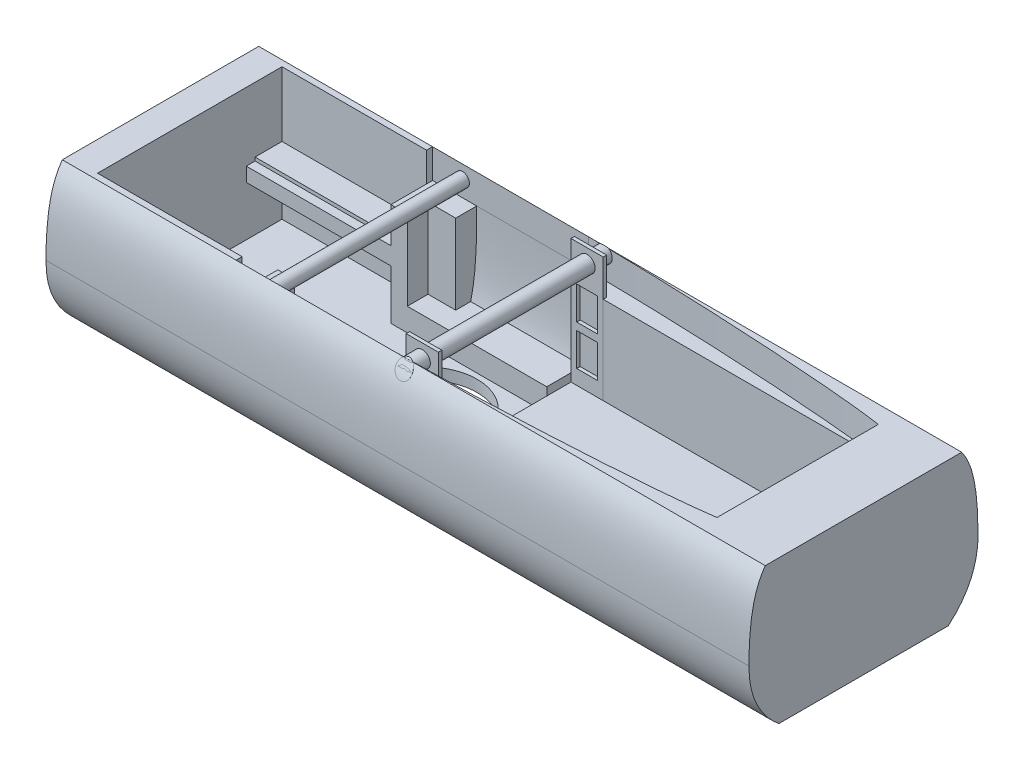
SolidWorks part; units mm, degrees
ref_plane "Front Plane" through (0, 0, 0) normal (0, 0, 1) x (1, 0, 0)
ref_plane "Top Plane" through (0, 0, 0) normal (0, 1, 0) x (1, 0, 0)
ref_plane "Right Plane" through (0, 0, 0) normal (1, 0, 0) x (0, 0, -1)
sketch "Sketch1" plane through (0, 0, 0) normal (0, 1, 0) x (1, 0, 0)
  line L0 (0, 0) -> (-260.7, 0) construction
  line L5 (0, 0) -> (0, -49)
  line L6 (0, -80) -> (-97, -80)
  line L7 (0, 0) -> (0, 49)
  line L8 (0, 49) -> (-135.2875, 49)
  line L9 (0, 49) -> (0, 68)
  line L10 (0, 68) -> (0, 80)
  line L11 (0, 80) -> (-97, 80)
  line L12 (-97, 80) -> (-97, 67)
  line L13 (-97, 67) -> (-121, 67)
  line L14 (-121, 67) -> (-121, 49)
  line L15 (-135.2875, 80) -> (-135.2875, 49)
  line L16 (0, -68) -> (0, -80)
  line L17 (0, -49) -> (0, -68)
  line L18 (0, -49) -> (-135.2875, -49)
  line L19 (-135.2875, -80) -> (-135.2875, -49)
  line L20 (-121, -67) -> (-121, -49)
  line L21 (-97, -67) -> (-121, -67)
  line L22 (-97, -80) -> (-97, -67)
  line L23 (-135.2875, 49) -> (-260.7, 49)
  line L24 (-260.7, 49) -> (-260.7, -49)
  line L25 (-260.7, -49) -> (-135.2875, -49)
  line L26 (-135.2875, 80) -> (-260.7, 80) construction
  line L27 (-260.7, 80) -> (-260.7, 49) construction
  line L28 (-97, 80) -> (-135.2875, 80) construction
  line L29 (0, 49) -> (266.7, 49)
  line L30 (266.7, 49) -> (266.7, -49)
  line L31 (266.7, -49) -> (0, -49)
  line L32 (0, 0) -> (266.7, 0) construction
  dimension "D1" = 97
  dimension "D2" = 12
  dimension "D3" = 19
  dimension "D4" = 13
  dimension "D5" = 24
  dimension "D6" = 18
  dimension "D7" = 98
  dimension "D8" = 139.7
  dimension "D9" = 14.2875
  dimension "D10" = 266.7
sketch "Sketch2" plane through (0, 0, 0) normal (0, 1, 0) x (1, 0, 0)
  line L0 (0, 49) -> (266.7, 49) construction
  line L1 (0, 49) -> (266.7, 49) construction
  line L2 (266.7, 49) -> (266.7, -49) construction
  line L3 (266.7, -49) -> (0, -49) construction
  line L4 (0, 0) -> (0, -49) construction
  line L5 (0, 0) -> (0, 49) construction
  line L6 (266.7, 49) -> (266.7, -49)
  line L7 (266.7, -49) -> (0, -49) construction
  line L8 (0, 0) -> (0, -49)
  line L9 (0, 0) -> (0, 49)
  line L10 (209.55, 49) -> (209.55, -49) construction
  line L11 (0, 0) -> (266.7, 0) construction
  line L12 (0, 49) -> (0, 70)
  line L13 (0, 70) -> (266.7, 70)
  line L14 (266.7, 70) -> (266.7, 49)
  line L15 (266.7, -70) -> (266.7, -49)
  line L16 (0, -70) -> (266.7, -70)
  line L17 (0, -49) -> (0, -70)
  spline S0 degree 3 poles (209.55, 49) (241.4641, 49.1492) (266.6642, 36.8994) (266.7, 17.25) knots 0 0 0 0 0.542084 0.542084 0.542084 0.542084 construction
  spline S1 degree 3 poles (209.55, -49) (241.4641, -49.1492) (266.6642, -36.8994) (266.7, -17.25) knots 0 0 0 0 0.542084 0.542084 0.542084 0.542084 construction
  dimension "D1" = 57.15
  dimension "D2" = 31.75
  dimension "D3" = 140
extrude "Boss-Extrude1" add sketch "Sketch2" along normal blind 13
sketch "Sketch3" plane through (0, 0, 0) normal (0, 1, 0) x (1, 0, 0)
  line L0 (0, 49) -> (-135.2875, 49) construction
  line L1 (0, -49) -> (-135.2875, -49) construction
  line L2 (0, -49) -> (0, -68) construction
  line L3 (0, -68) -> (0, -80) construction
  line L4 (-97, -80) -> (-97, -67) construction
  line L5 (-121, -67) -> (-121, -49) construction
  line L6 (-97, -67) -> (-121, -67) construction
  line L7 (0, -80) -> (-97, -80) construction
  line L8 (0, 49) -> (0, 68) construction
  line L9 (0, 68) -> (0, 80) construction
  line L10 (0, 80) -> (-97, 80) construction
  line L11 (-97, 80) -> (-97, 67) construction
  line L12 (-97, 67) -> (-121, 67) construction
  line L13 (-121, 67) -> (-121, 49) construction
  line L14 (0, 49) -> (-121, 49)
  line L15 (0, -49) -> (-121, -49)
  line L16 (0, -49) -> (0, -68)
  line L17 (0, -68) -> (0, -80)
  line L18 (-97, -80) -> (-97, -67)
  line L19 (-121, -67) -> (-121, -49)
  line L20 (-97, -67) -> (-121, -67)
  line L21 (0, -80) -> (-97, -80)
  line L22 (0, 49) -> (0, 68)
  line L23 (0, 68) -> (0, 80)
  line L24 (0, 80) -> (-97, 80)
  line L25 (-97, 80) -> (-97, 67)
  line L26 (-97, 67) -> (-121, 67)
  line L27 (-121, 67) -> (-121, 49)
extrude "Boss-Extrude2" add sketch "Sketch3" along normal blind 20 separate body
sketch "Sketch4" plane through (0, 0, 0) normal (0, 1, 0) x (1, 0, 0)
  line L0 (-97, 80) -> (-135.2875, 80) construction
  line L1 (-97, 80) -> (-97, 67) construction
  line L2 (-97, 67) -> (-121, 67) construction
  line L3 (-121, 67) -> (-121, 49) construction
  line L4 (0, 49) -> (-135.2875, 49) construction
  line L5 (-135.2875, 80) -> (-135.2875, 49) construction
  line L6 (-97, 80) -> (-135.2875, 80) construction
  line L7 (-97, 80) -> (-97, 67)
  line L8 (-97, 67) -> (-121, 67)
  line L9 (-121, 67) -> (-121, 49)
  line L10 (-121, 49) -> (-135.2875, 49)
  line L11 (-135.2875, 80) -> (-135.2875, 49)
  line L12 (-260.7, 0) -> (0, 0) construction
  line L13 (-260.7, 49) -> (-260.7, -49) construction
  line L14 (-135.2875, -80) -> (-135.2875, -49)
  line L15 (-121, -49) -> (-135.2875, -49)
  line L16 (-121, -67) -> (-121, -49)
  line L19 (-97, -80) -> (-135.2875, -80) construction
  line L20 (-135.2875, 80) -> (-135.2875, 105)
  line L21 (-135.2875, 105) -> (323.8, 105)
  line L22 (-135.2875, -105) -> (323.8, -105)
  line L23 (-135.2875, -80) -> (-135.2875, -105)
  line L24 (19, 49) -> (19, -49) construction
  line L25 (19, 49) -> (0, 49) construction
  line L26 (19, -49) -> (0, -49) construction
  line L27 (323.8, -105) -> (323.8, 105)
  line L35 (-121, -67) -> (-97, -67) construction
  line L36 (-97, -67) -> (-97, -80) construction
  line L37 (-97, -80) -> (0, -80) construction
  line L38 (0, -80) -> (0, -49) construction
  line L40 (266.7, 49) -> (266.7, -49) construction
  line L42 (0, 49) -> (0, 80) construction
  line L43 (0, 80) -> (-97, 80) construction
  line L44 (-121, -67) -> (-97, -67)
  line L45 (-97, -67) -> (-97, -80)
  line L46 (-97, -80) -> (0, -80)
  line L47 (0, -80) -> (0, -70)
  line L49 (266.7, 70) -> (266.7, -70)
  line L51 (0, 70) -> (0, 80)
  line L52 (0, 80) -> (-97, 80)
  line L53 (266.7, 70) -> (0, 70) construction
  line L54 (266.7, 70) -> (0, 70)
  line L55 (0, -70) -> (266.7, -70) construction
  line L56 (0, -70) -> (266.7, -70)
  line L57 (0, 49) -> (0, 70) construction
  line L58 (0, -70) -> (0, -49) construction
  dimension "D1" = 210
  dimension "D2" = 19
  dimension "D3" = 304.8
extrude "Boss-Extrude3" add sketch "Sketch4" along normal blind 89.2
sketch "Sketch5" plane through (0, 0, 0) normal (0, 1, 0) x (1, 0, 0)
  line L1 (-260.7, 49) -> (-260.7, -49) construction
  line L4 (-260.7, 49) -> (-260.7, -49)
  line L6 (-260.7, 80) -> (-260.7, 49) construction
  line L7 (-135.2875, 80) -> (-260.7, 80) construction
  line L8 (0, -49) -> (-135.2875, -49)
  line L9 (0, 49) -> (0, -49)
  line L10 (-135.2875, 49) -> (0, 49)
  line L11 (-135.2875, 105) -> (-135.2875, 49)
  line L12 (323.8, 105) -> (-135.2875, 105)
  line L13 (323.8, -105) -> (323.8, 105)
  line L14 (-135.2875, -105) -> (323.8, -105)
  line L15 (-135.2875, -49) -> (-135.2875, -105)
  line L19 (-135.2875, 105) -> (-135.2875, 80)
  line L20 (323.8, 105) -> (-135.2875, 105)
  line L21 (323.8, -105) -> (323.8, 105)
  line L22 (-135.2875, -105) -> (323.8, -105)
  line L23 (-135.2875, -80) -> (-135.2875, -105)
  line L24 (-260.7, 80) -> (-260.7, 49)
  line L25 (-135.2875, 80) -> (-260.7, 80)
  line L26 (-260.7, 0) -> (0, 0) construction
  line L27 (-135.2875, -80) -> (-260.7, -80)
  line L28 (-260.7, -80) -> (-260.7, -49)
  dimension "D1" = 0
extrude "Boss-Extrude4" add sketch "Sketch5" against normal blind 10
sketch "Sketch7" plane through (0, 89.2, 0) normal (0, 1, 0) x (1, 0, 0)
  line L0 (0, 0) -> (266.7, 0) construction
  line L1 (0, 70) -> (28, 70)
  line L2 (0, 70) -> (0, 73)
  line L3 (0, 73) -> (28, 73)
  line L4 (28, 70) -> (28, 73)
  line L5 (266.7, -70) -> (266.7, 70) construction
  line L6 (28, -70) -> (28, -73)
  line L7 (0, -73) -> (28, -73)
  line L8 (0, -70) -> (0, -73)
  line L9 (0, -70) -> (28, -70)
  dimension "D1" = 3
  dimension "D2" = 28
extrude "Cut-Extrude1" cut sketch "Sketch7" against normal up to surface (76.2 mm away) contours L3 L4 L1 L2
sketch "Sketch8" plane through (0, 13, 0) normal (0, 1, 0) x (1, 0, 0)
  line L0 (0, 0) -> (266.7, 0) construction
  line L1 (28, 73) -> (0, 73)
  line L2 (28, 73) -> (28, 70)
  line L3 (28, 70) -> (0, 70)
  line L4 (0, 73) -> (0, 70)
  line L5 (0, 49) -> (0, -49) construction
  line L6 (266.7, -70) -> (266.7, 70) construction
  line L7 (0, -73) -> (0, -70)
  line L8 (28, -70) -> (0, -70)
  line L9 (28, -73) -> (28, -70)
  line L10 (28, -73) -> (0, -73)
  line L11 (0, 73) -> (0, 49) construction
extrude "Boss-Extrude6" add sketch "Sketch8" along normal blind 107.95 separate body
sketch "Sketch9" plane through (0, 0, -70) normal (0, 0, 1) x (1, 0, 0)
  line L0 (14, 115.95) -> (14, 120.95) construction
  line L1 (0, 120.95) -> (28, 120.95) construction
  circle A0 centre (14, 108.95) radius 7
  dimension "D2" = 14
  dimension "D1" = 5
extrude "Boss-Extrude7" add sketch "Sketch9" along normal up to surface and the other way up to surface separate body
sketch "Sketch11" plane through (0, 0, 0) normal (0, 1, 0) x (1, 0, 0)
  line L0 (-88.9, 6.98) -> (-88.9, -6.98)
  line L1 (-22.86, 6.98) -> (-22.86, -6.98)
  line L2 (-55.88, 40) -> (-55.88, -40) construction
  line L3 (-88.9, 0) -> (0, 0) construction
  arc A0 (-22.86, 6.98) -> (-88.9, 6.98) centre (-55.88, 6.98) ccw
  arc A1 (-88.9, -6.98) -> (-22.86, -6.98) centre (-55.88, -6.98) ccw
  arc A2 (-22.86, -6.98) -> (-88.9, -6.98) centre (-55.88, -6.98) ccw construction
  arc A3 (-88.9, 6.98) -> (-22.86, 6.98) centre (-55.88, 6.98) ccw construction
  point P1 (-55.88, -40)
  point P3 (-55.88, 40)
  point P14 (-22.86, 0)
  dimension "D1" = 66.04
  dimension "D2" = 80
  dimension "D3" = 22.86
extrude "Cut-Extrude2" cut sketch "Sketch11" against normal blind 2
sketch "Sketch12" plane through (0, 0, -70) normal (0, 0, 1) x (1, 0, 0)
  line L0 (5, 60.625) -> (5, 54.275) construction
  line L1 (5, 89.2) -> (23, 89.2)
  line L2 (5, 89.2) -> (5, 60.625)
  line L3 (5, 60.625) -> (23, 60.625)
  line L4 (23, 89.2) -> (23, 60.625)
  line L5 (5, 89.2) -> (23, 60.625) construction
  line L6 (5, 60.625) -> (23, 89.2) construction
  line L7 (5, 54.275) -> (23, 54.275)
  line L8 (5, 54.275) -> (5, 25.7)
  line L9 (5, 25.7) -> (23, 25.7)
  line L10 (23, 54.275) -> (23, 25.7)
  line L11 (5, 54.275) -> (23, 25.7) construction
  line L12 (5, 25.7) -> (23, 54.275) construction
  line L14 (23, 60.625) -> (23, 54.275) construction
  line L15 (28, 89.2) -> (266.7, 89.2) construction
  line L16 (28, 120.95) -> (28, 13) construction
  line L17 (0, 120.95) -> (0, 13) construction
  line L18 (0, 13) -> (28, 13) construction
  point P0 (14, 74.9125)
  point P7 (14, 39.9875)
  dimension "D1" = 5
  dimension "D2" = 5
  dimension "D4" = 6.35
  dimension "D5" = 12.7
extrude "Cut-Extrude3" cut sketch "Sketch12" against normal up to surface and the other way up to surface
sketch "Sketch13" plane through (0, -10, 0) normal (0, 1, 0) x (1, 0, 0)
  line L0 (-135.2875, 105) -> (-286.1, 105)
  line L1 (-286.1, 105) -> (-286.1, -105)
  line L2 (-286.1, -105) -> (-135.2875, -105)
  line L3 (-260.7, 0) -> (-286.1, 0) construction
  line L4 (-260.7, 80) -> (-260.7, -80) construction
  line L6 (-135.2875, 80) -> (-260.7, 80) construction
  line L7 (-260.7, 80) -> (-260.7, -80) construction
  line L8 (-260.7, -80) -> (-135.2875, -80) construction
  line L9 (-135.2875, 105) -> (-135.2875, 80) construction
  line L10 (-135.2875, 105) -> (-135.2875, 80)
  line L11 (-260.7, -80) -> (-135.2875, -80)
  line L12 (-260.7, 80) -> (-260.7, -80)
  line L13 (-135.2875, 80) -> (-260.7, 80)
  line L14 (-135.2875, -80) -> (-135.2875, -105)
  dimension "D1" = 25.4
extrude "Boss-Extrude10" add sketch "Sketch13" along normal blind 124.6
sketch "Sketch15" plane through (-135.2875, 0, 0) normal (-1, 0, 0) x (0, 0, 1)
  line L0 (-80, 89.2) -> (-80, 0) construction
  line L1 (-80, 58.42) -> (-49, 58.42)
  line L2 (-80, 58.42) -> (-80, 43.18)
  line L3 (-80, 43.18) -> (-49, 43.18)
  line L4 (-49, 58.42) -> (-49, 43.18)
  line L6 (-80, 0) -> (-49, 0) construction
  line L10 (49, 58.42) -> (80, 58.42)
  line L11 (49, 58.42) -> (49, 43.18)
  line L12 (49, 43.18) -> (80, 43.18)
  line L13 (80, 58.42) -> (80, 43.18)
  line L14 (80, 89.2) -> (80, 0) construction
  line L16 (-49, 58.42) -> (49, 58.42) construction
  line L17 (49, 43.18) -> (-49, 43.18) construction
  line L20 (-49, 89.2) -> (-49, 0) construction
  line L21 (49, 89.2) -> (49, 0) construction
  dimension "D1" = 58.42
  dimension "D2" = 43.18
extrude "Boss-Extrude11" add sketch "Sketch15" along normal up to vertex (125.4125 mm away)
sketch "Sketch16" plane through (0, 58.42, 0) normal (0, 1, 0) x (1, 0, 0)
  line L0 (-260.7, -49) -> (-135.2875, -49) construction
  line L1 (-260.7, 56.62) -> (-147.9875, 56.62)
  line L2 (-260.7, 56.62) -> (-260.7, -56.62)
  line L3 (-260.7, -56.62) -> (-147.9875, -56.62)
  line L4 (-147.9875, 56.62) -> (-147.9875, -56.62)
  line L5 (-260.7, 49) -> (-135.2875, 49) construction
  line L6 (-135.2875, 49) -> (-135.2875, 80) construction
  line L7 (-260.7, 49) -> (-260.7, 80) construction
  dimension "D1" = 7.62
  dimension "D2" = 113.24
  dimension "D3" = 7.62
  dimension "D4" = 12.7
extrude "Cut-Extrude4" cut sketch "Sketch16" against normal blind 3
sketch "Sketch18" plane through (0, 0, 0) normal (-1, 0, 0) x (0, 0, 1)
  line L1 (-70, 89.2) -> (-85.24, 89.2)
  line L3 (-70, 120.95) -> (-70, 13) construction
  line L6 (-70, 89.2) -> (-70, 20)
  line L7 (-49, 20) -> (-73, 20) construction
  line L8 (-70, 20) -> (-80, 20)
  line L9 (-80, 89.2) -> (-73, 89.2) construction
  spline S0 degree 3 poles (-80, 20) (-85.4858, 41.6668) (-85.2643, 70.979) (-85.24, 89.2) knots 0 0 0 0 1 1 1 1
  dimension "D1" = 15.24
sketch "Sketch19" plane through (-97, 0, 0) normal (1, 0, 0) x (0, 0, -1)
  line L0 (70, 20) -> (80, 20) construction
  line L1 (70, 89.2) -> (70, 20) construction
  line L3 (70, 20) -> (80, 20)
  line L4 (70, 89.2) -> (70, 20)
  line L5 (85.24, 89.2) -> (70, 89.2)
  spline S0 degree 3 poles (-834.739, 1793.0439) (835.5153, -2222.7847) (-526.0785, 2383.8665) (582.9009, -1847.8491) knots -4.415422 -4.415422 -4.415422 -4.415422 5.35228 5.35228 5.35228 5.35228 only from (80, 20) to (85.24, 89.2) construction
  spline S1 degree 3 poles (80, 20) (85.4858, 41.6668) (85.2643, 70.979) (85.24, 89.2) knots 0 0 0 0 1 1 1 1
loft "Cut-Loft1" cut profiles "Sketch19", "Sketch18"
mirror "Mirror1" about plane through (0, 0, 0) normal (0, 0, 1) of "Cut-Loft1"
sketch "Sketch6" plane through (0, 89.2, 0) normal (0, 1, 0) x (1, 0, 0)
  line L0 (323.8, 105) -> (-135.2875, 105) construction
  line L4 (323.8, -105) -> (323.8, 105) construction
  line L5 (-135.2875, -105) -> (323.8, -105) construction
  line L10 (323.8, 105) -> (-135.2875, 105)
  line L11 (323.8, -105) -> (323.8, 105)
  line L12 (-135.2875, -105) -> (323.8, -105)
  line L13 (-135.2875, 105) -> (-135.2875, 85.24)
  line L15 (-135.2875, 85.24) -> (0, 85.24)
  line L16 (-135.2875, 80) -> (-135.2875, 49) construction
  line L19 (0, 0) -> (266.7, 0) construction
  line L20 (266.7, 70) -> (266.7, -70) construction
  line L21 (266.7, 70) -> (266.7, 0)
  line L22 (266.7, 0) -> (266.7, -70)
  line L23 (0, -85.24) -> (-135.2875, -85.24)
  line L24 (-135.2875, -49) -> (-135.2875, -80) construction
  line L25 (-135.2875, -85.24) -> (-135.2875, -105)
  line L26 (-97, 85.24) -> (0, 85.24) construction
  spline S0 degree 3 poles (0, 85.24) (130.863, 83.6512) (236.6774, 74.6668) (266.7, 70) knots 0 0 0 0 1 1 1 1
  spline S1 degree 3 poles (0, -85.24) (130.863, -83.6512) (236.6774, -74.6668) (266.7, -70) knots 0 0 0 0 1 1 1 1
extrude "Boss-Extrude5" add sketch "Sketch6" along normal blind 25.4
sketch "Sketch20" plane through (0, 0, -85.24) normal (0, 0, 1) x (1, 0, 0)
  line L0 (-109.2936, 108.95) -> (14, 108.95) construction
  line L1 (-97, 89.2) -> (-97, 108.95) construction
  circle A0 centre (-109.2936, 103.0064) radius 5.9436
  circle A1 centre (14, 108.95) radius 7 construction
  point P7 (-103.35, 103.0064)
  dimension "D1" = 11.8872
  dimension "D2" = 6.35
extrude "Boss-Extrude12" add sketch "Sketch20" along normal up to surface (170.48 mm away) separate body contours A0
sketch "Sketch21" plane through (-260.7, 0, 0) normal (1, 0, 0) x (0, 0, -1)
  line L0 (80, 0) -> (-80, 0) construction
  line L1 (-11.43, 0) -> (11.43, 0)
  line L2 (-11.43, 0) -> (-11.43, 17.78)
  line L3 (-11.43, 17.78) -> (11.43, 17.78)
  line L4 (11.43, 0) -> (11.43, 17.78)
  line L5 (0, 0) -> (0, 17.78) construction
  dimension "D1" = 22.86
  dimension "D2" = 17.78
extrude "Cut-Extrude5" cut sketch "Sketch21" against normal through all
sketch "Sketch22" plane through (323.8, 0, 0) normal (1, 0, 0) x (0, 0, -1)
  line L0 (0, 52.3) -> (0, -34.0162) construction
  line L1 (0, 138.6162) -> (-99.3467, 138.6162) construction
  line L2 (-99.3467, 138.6162) -> (-99.3467, 46.1162) construction
  line L3 (-99.3467, 46.1162) -> (-99.3467, -34.0162) construction
  line L4 (-99.3467, -34.0162) -> (0, -34.0162) construction
  line L5 (0, 52.3) -> (105, 52.3) construction
  line L6 (105, 114.6) -> (105, -10) construction
  line L7 (0, 138.6162) -> (0, 52.3) construction
  line L8 (0, 52.3) -> (-105, 52.3) construction
  line L9 (-105, 114.6) -> (-105, -10) construction
  spline S0 degree 3 poles (-99.3467, 46.1162) (-99.2438, 124.7536) (-77.2582, 138.5585) (0, 138.6162) knots 0 0 0 0 1 1 1 1
  spline S1 degree 3 poles (-99.3467, 46.1162) (-100.0107, -9.4605) (-45.5581, -34.2581) (0, -34.0162) knots 0 0 0 0 1 1 1 1
  spline S2 degree 3 poles (99.3467, 46.1162) (100.0107, -9.4605) (45.5581, -34.2581) (0, -34.0162) knots 0 0 0 0 1 1 1 1
  spline S3 degree 3 poles (99.3467, 46.1162) (99.2438, 124.7536) (77.2582, 138.5585) (0, 138.6162) knots 0 0 0 0 1 1 1 1
  dimension "D1" = 80.1324
  dimension "D2" = 92.5
  dimension "D3" = 99.3467
  dimension "D4" = 99.3467
extrude "Cut-Extrude6" cut sketch "Sketch22" against normal through all flip side to cut
sketch "Sketch23" plane through (0, -2, 0) normal (0, 1, 0) x (1, 0, 0)
  line L0 (-55.88, 40) -> (-55.88, -40) construction
  line L1 (-88.9, 0) -> (-22.86, 0) construction
  line L2 (-88.9, 6.98) -> (-88.9, -6.98) construction
  line L3 (-22.86, -6.98) -> (-22.86, 6.98) construction
  arc A0 (-22.86, 6.98) -> (-88.9, 6.98) centre (-55.88, 6.98) ccw construction
  arc A1 (-88.9, -6.98) -> (-22.86, -6.98) centre (-55.88, -6.98) ccw construction
  circle A2 centre (-55.88, 0) radius 44.45
  point P14 (-55.88, 0)
  dimension "D1" = 88.9
extrude "Cut-Extrude7" cut sketch "Sketch23" against normal through all both and the other way through all contours A2
